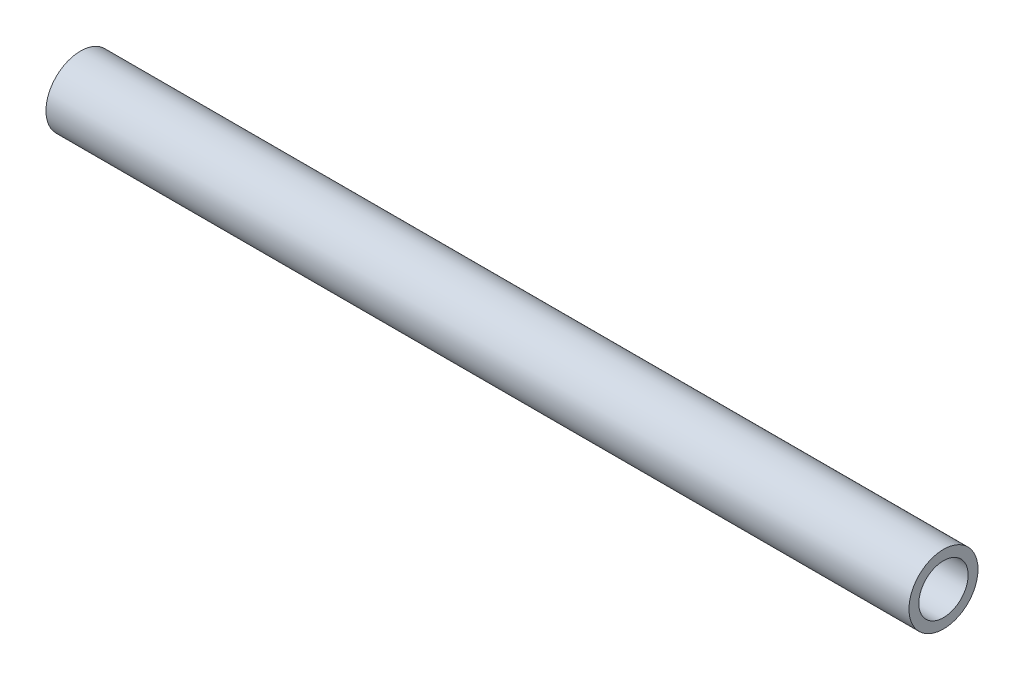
SolidWorks part; units mm, degrees
ref_plane "Front" through (0, 0, 0) normal (0, 0, 1) x (1, 0, 0)
ref_plane "Top" through (0, 0, 0) normal (0, 1, 0) x (1, 0, 0)
ref_plane "Right" through (0, 0, 0) normal (1, 0, 0) x (0, 0, -1)
sketch "Sketch1" plane through (0, 0, 0) normal (0, 0, 1) x (1, 0, 0)
  line L0 (0, 0) -> (266.7, 0)
  line L1 (9.9848, 0) -> (-9.9848, 0) construction
  dimension "D1" = 266.7
other "Structural Member1"
ref_plane "Plane1" through (0, 0, 0) normal (1, 0, 0) x (0, 0, -1)
sketch "Sketch11" plane through (0, 0, 0) normal (1, 0, 0) x (0, 0, -1)
  circle A0 centre (0, 0) radius 7.62
  circle A1 centre (0, 0) radius 10.668
  point P3 (0, 0)
  dimension "D1" = 21.336
  dimension "D2" = 15.24
